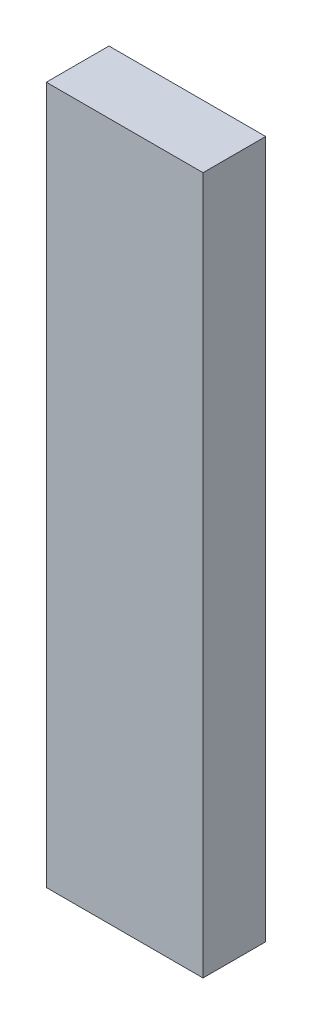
SolidWorks part; units mm, degrees
ref_plane "Plan de face" through (0, 0, 0) normal (0, 0, 1) x (1, 0, 0)
ref_plane "Plan de dessus" through (0, 0, 0) normal (0, 1, 0) x (1, 0, 0)
ref_plane "Plan de droite" through (0, 0, 0) normal (1, 0, 0) x (0, 0, -1)
sketch "Esquisse1" plane through (0, 0, 0) normal (0, 0, 1) x (1, 0, 0)
  line L1 (0, 0) -> (20, 0)
  line L2 (0, 0) -> (0, 89)
  line L3 (0, 89) -> (20, 89)
  line L4 (20, 0) -> (20, 89)
  dimension "D1" = 20
  dimension "D2" = 89
extrude "Extrusion1" add sketch "Esquisse1" along normal blind 8
